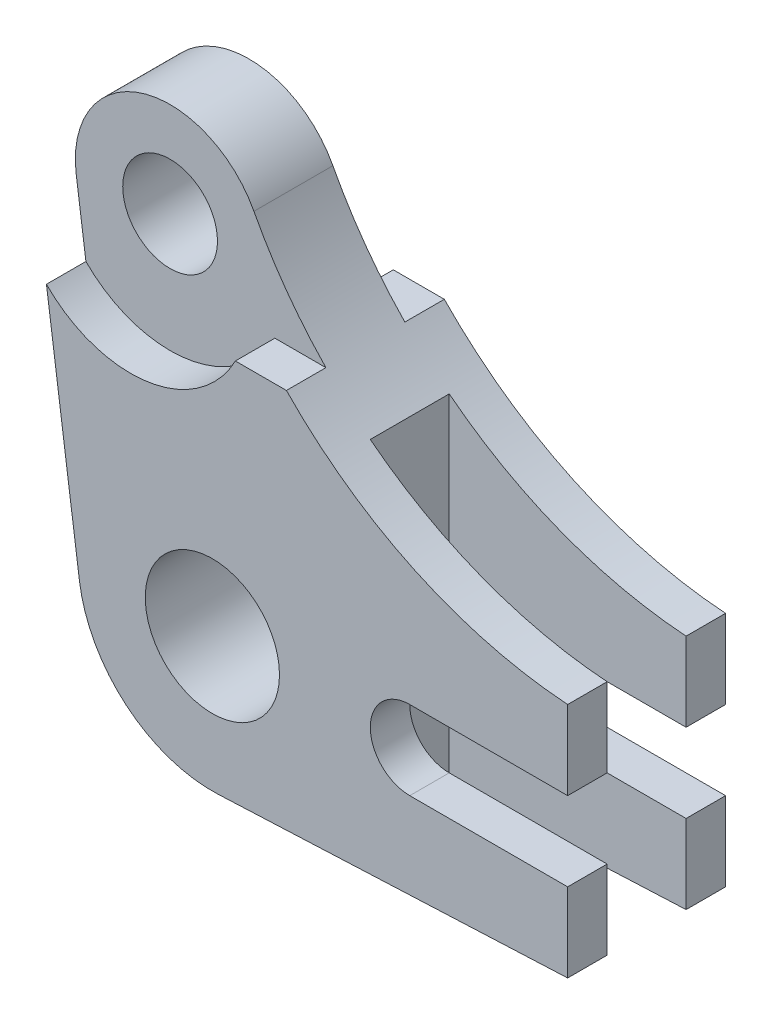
SolidWorks part; units mm, degrees
ref_plane "Front Plane" through (0, 0, 0) normal (0, 0, 1) x (1, 0, 0)
ref_plane "Top Plane" through (0, 0, 0) normal (0, 1, 0) x (1, 0, 0)
ref_plane "Right Plane" through (0, 0, 0) normal (1, 0, 0) x (0, 0, -1)
sketch "Sketch2" plane through (0, 0, 0) normal (0, 0, 1) x (1, 0, 0)
  line L0 (53.3921, 0) -> (0, 0) construction
  line L1 (0, 0) -> (0, 40.9244) construction
  line L2 (0, 0) -> (-18.6623, 69.6485) construction
  line L3 (31.75, 6.35) -> (57.15, 6.35)
  line L4 (57.15, 6.35) -> (57.15, 19.05)
  line L5 (31.75, -6.35) -> (57.15, -6.35)
  line L6 (57.15, -6.35) -> (57.15, -19.05)
  line L7 (57.15, -19.05) -> (0.9668, -21.5683)
  line L8 (-28.2463, 46.9957) -> (-21.3893, -2.9373)
  circle A0 centre (0, 0) radius 10.795
  arc A1 (-21.3893, -2.9373) -> (0.9668, -21.5683) centre (0, 0) ccw
  arc A2 (31.75, 6.35) -> (31.75, -6.35) centre (31.75, 0) ccw
  circle A3 centre (-13.148, 49.069) radius 7.62
  arc A4 (0.336, 56.171) -> (-28.2463, 46.9957) centre (-13.148, 49.069) ccw
  arc A5 (0.336, 56.171) -> (57.15, 19.05) centre (62.138, 88.7217) ccw
  dimension "D1" = 21.59
  dimension "D2" = 21.59
  dimension "D4" = 15.24
  dimension "D6" = 15.24
  dimension "D11" = 69.85
  dimension "D3" = 15
  dimension "D5" = 50.8
  dimension "D7" = 12.7
  dimension "D8" = 25.4
  dimension "D9" = 57.15
  dimension "D10" = 38.1
  dimension "D12" = 12.7
extrude "Boss-Extrude1" add sketch "Sketch2" along normal mid plane 25.4
sketch "Sketch3" plane through (0, 0, 12.7) normal (0, 0, 1) x (1, 0, 0)
  line L0 (-28.2463, 46.9957) -> (-21.3893, -2.9373) construction
  line L1 (-28.2463, 46.9957) -> (-26.6913, 35.6719)
  line L2 (11.9121, 40.179) -> (3.7004, 40.179)
  arc A0 (0.336, 56.171) -> (57.15, 19.05) centre (62.138, 88.7217) ccw construction
  arc A1 (0.336, 56.171) -> (-28.2463, 46.9957) centre (-13.148, 49.069) ccw construction
  arc A2 (0.336, 56.171) -> (11.9121, 40.179) centre (62.138, 88.7217) ccw
  arc A3 (0.336, 56.171) -> (-28.2463, 46.9957) centre (-13.148, 49.069) ccw
  arc A4 (-26.6913, 35.6719) -> (3.7004, 40.179) centre (-13.148, 49.069) ccw
  dimension "D1" = 19.05
  dimension "D2" = 8.89
extrude "Cut-Extrude1" cut sketch "Sketch3" against normal blind 6.35
mirror "Mirror1" about plane through (0, 0, 0) normal (0, 0, 1) of "Cut-Extrude1"
sketch "Sketch4" plane through (57.15, 0, 0) normal (1, 0, 0) x (0, 0, -1)
  line L0 (-12.7, -21.5683) -> (12.7, -21.5683) construction
  line L1 (-6.35, -21.5683) -> (6.35, -21.5683)
  line L2 (-6.35, -21.5683) -> (-6.35, 40.179)
  line L3 (-6.35, 40.179) -> (6.35, 40.179)
  line L4 (6.35, -21.5683) -> (6.35, 40.179)
  line L5 (0, 0) -> (0, 71.6753) construction
  line L6 (6.35, 40.179) -> (12.7, 40.179) construction
  dimension "D1" = 12.7
extrude "Cut-Extrude2" cut sketch "Sketch4" against normal blind 38.1
